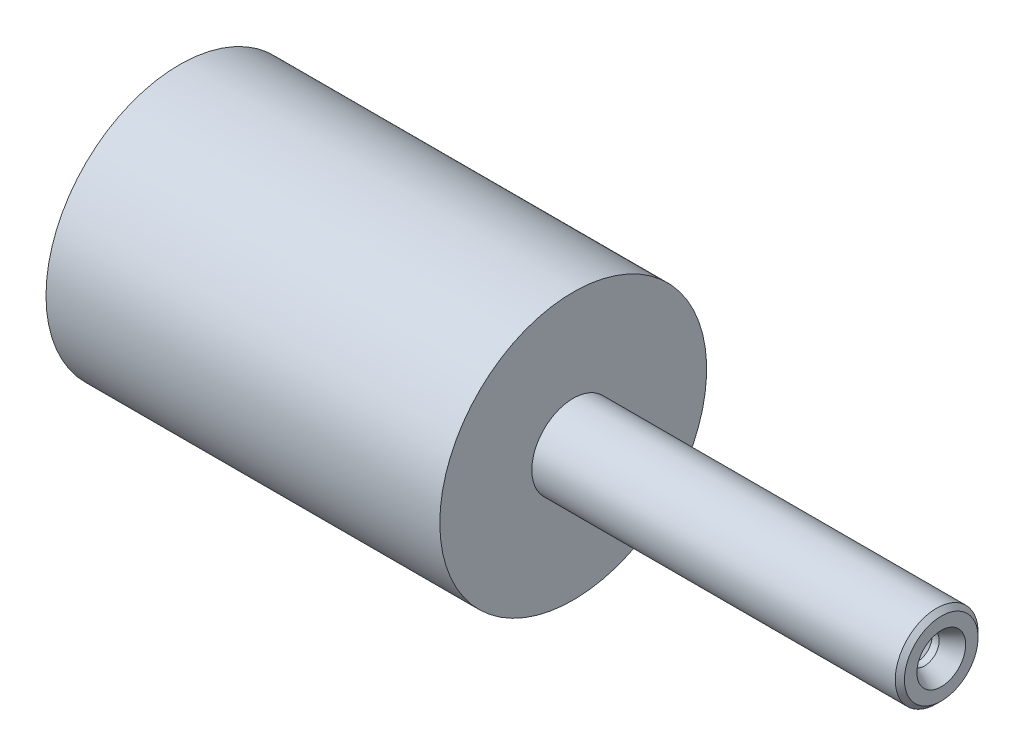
SolidWorks part; units mm, degrees
ref_plane "Plan de face" through (0, 0, 0) normal (0, 0, 1) x (1, 0, 0)
ref_plane "Plan de dessus" through (0, 0, 0) normal (0, 1, 0) x (1, 0, 0)
ref_plane "Plan de droite" through (0, 0, 0) normal (1, 0, 0) x (0, 0, -1)
ref_plane "Plan4" through (0, 0, 0) normal (0, 0, 1) x (1, 0, 0)
sketch "Esquisse1" plane through (0, 0, 0) normal (0, 0, 1) x (1, 0, 0)
  line L0 (0, 0) -> (0, 4.5)
  line L1 (0, 4.5) -> (19.5, 4.5)
  line L2 (19.5, 4.5) -> (20, 4)
  line L3 (20, 4) -> (20, 0)
  line L4 (20, 0) -> (0, 0)
  line L5 (20, 0) -> (0, 0) construction
revolve "Révolution1" add sketch "Esquisse1" angle 360 about L5
ref_plane "Plan5" through (0, 0, 0) normal (0, 0, 1) x (1, 0, 0)
sketch "Esquisse2" plane through (0, 0, 0) normal (0, 0, 1) x (1, 0, 0)
  line L0 (7.2901, 0) -> (8, 1.2295)
  line L1 (8, 1.2295) -> (17.0295, 1.2295)
  line L2 (17.0295, 1.2295) -> (17.4, 1.6)
  line L3 (17.4, 1.6) -> (18.1813, 1.6)
  line L4 (18.1813, 1.6) -> (20, 2.65)
  line L5 (20, 2.65) -> (20, 0)
  line L6 (20, 0) -> (7.2901, 0)
  line L7 (20, 0) -> (7.2901, 0) construction
revolve "Enlèvement de matière-Révolution1" cut sketch "Esquisse2" angle 360 about L7
sketch "Esquisse3" plane through (0, 0, 0) normal (-1, 0, 0) x (0, 0, 1)
  circle A0 centre (0, 0) radius 4.5 construction
  circle A1 centre (0, 0) radius 4.5
extrude "Extrusion1" add sketch "Esquisse3" along normal blind 20
sketch "Esquisse4" plane through (-20, 0, 0) normal (-1, 0, 0) x (0, 0, 1)
  circle A0 centre (0, 0) radius 14.5
  dimension "D1" = 29
extrude "Extrusion2" add sketch "Esquisse4" along normal blind 42.8
